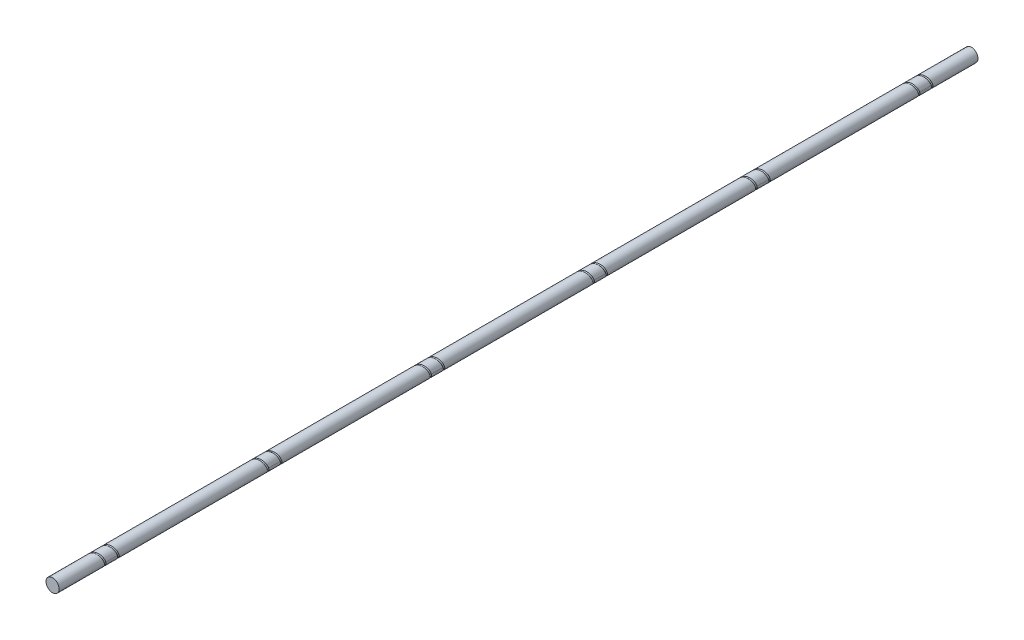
SolidWorks part; units mm, degrees
ref_plane "Front Plane" through (0, 0, 0) normal (0, 0, 1) x (1, 0, 0)
ref_plane "Top Plane" through (0, 0, 0) normal (0, 1, 0) x (1, 0, 0)
ref_plane "Right Plane" through (0, 0, 0) normal (1, 0, 0) x (0, 0, -1)
sketch "Sketch1" plane through (0, 0, 0) normal (0, 0, 1) x (1, 0, 0)
  circle A0 centre (0, 0) radius 25
  dimension "D1" = 50
extrude "Boss-Extrude1" add sketch "Sketch1" along normal blind 3500
ref_plane "Plane1" through (0, 0, 150) normal (0, 0, 1) x (1, 0, 0)
sketch "Sketch2" plane through (0, 0, 150) normal (0, 0, 1) x (1, 0, 0)
  circle A0 centre (0, 0) radius 27.646
  dimension "D1" = 55.292
curve "Helix/Spiral1"
sketch "Sketch3" plane through (0, 0, 0) normal (0, 1, 0) x (1, 0, 0)
  circle A0 centre (-27.646, -150) radius 3.969
  spline S0 degree 3 poles (-27.646, -150) (-27.646, -150.7073) (-26.9833, -152.1286) (-24.0718, -154.2551) (-19.4496, -156.383) (-13.4454, -158.5106) (-6.4857, -160.6383) (0.9349, -162.766) (8.289, -164.8936) (15.0541, -167.0213) (20.7495, -169.1489) (24.9703, -171.2766) (27.4167, -173.4043) (27.9149, -175.5319) (26.4293, -177.6596) (23.0657, -179.7872) (18.063, -181.9149) (11.7766, -184.0426) (4.6535, -186.1702) (-2.8004, -188.2979) (-10.0553, -190.4255) (-16.5956, -192.5532) (-21.9566, -194.6809) (-25.7573, -196.8085) (-27.7277, -198.9362) (-27.7277, -201.0638) (-25.7573, -203.1915) (-21.9566, -205.3191) (-16.5956, -207.4468) (-10.0553, -209.5745) (-2.8004, -211.7021) (4.6535, -213.8298) (11.7766, -215.9574) (18.063, -218.0851) (23.0657, -220.2128) (26.4293, -222.3404) (27.9149, -224.4681) (27.4167, -226.5957) (24.9703, -228.7234) (20.7495, -230.8511) (15.0541, -232.9787) (8.289, -235.1064) (0.9349, -237.234) (-6.4857, -239.3617) (-13.4454, -241.4894) (-19.4496, -243.617) (-24.0718, -245.7449) (-26.9833, -247.8714) (-27.646, -249.2927) (-27.646, -250) knots 0 0 0 0 0.021277 0.042553 0.06383 0.085106 0.106383 0.12766 0.148936 0.170213 0.191489 0.212766 0.234043 0.255319 0.276596 0.297872 0.319149 0.340426 0.361702 0.382979 0.404255 0.425532 0.446809 0.468085 0.489362 0.510638 0.531915 0.553191 0.574468 0.595745 0.617021 0.638298 0.659574 0.680851 0.702128 0.723404 0.744681 0.765957 0.787234 0.808511 0.829787 0.851064 0.87234 0.893617 0.914894 0.93617 0.957447 0.978723 1 1 1 1 construction
  dimension "D1" = 7.938
sweep "Cut-Sweep1" cut profiles "Sketch3" path "Helix/Spiral1"
pattern_linear "LPattern1" count 6 spacing 620 along (0, 0, -1) of "Cut-Sweep1"
